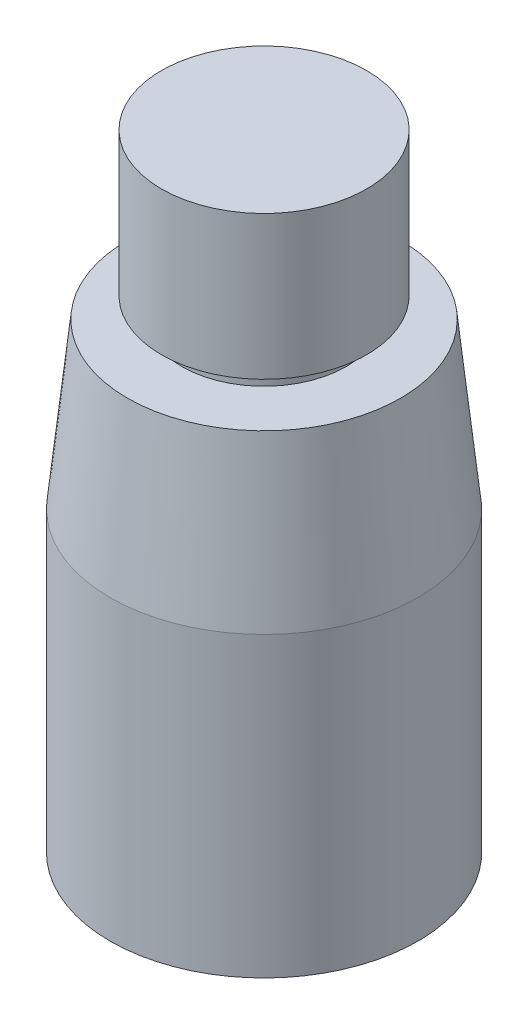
SolidWorks part; units mm, degrees
ref_plane "Front Plane" through (0, 0, 0) normal (0, 0, 1) x (1, 0, 0)
ref_plane "Top Plane" through (0, 0, 0) normal (0, 1, 0) x (1, 0, 0)
ref_plane "Right Plane" through (0, 0, 0) normal (1, 0, 0) x (0, 0, -1)
sketch "Sketch1" plane through (0, 0, 0) normal (0, 0, 1) x (1, 0, 0)
  line L0 (0, 85.1026) -> (0, 0) construction
  line L1 (0, 0) -> (-7.5, 0)
  line L2 (-7.5, 0) -> (-7.5, 14.5)
  line L3 (-7.5, 14.5) -> (-6.6592, 22.5)
  line L4 (-6.6592, 22.5) -> (-4, 22.5)
  line L5 (-4, 22.5) -> (-4, 23.5)
  line L6 (-4, 23.5) -> (-5, 23.5)
  line L7 (-5, 23.5) -> (-5, 30.5)
  line L8 (-5, 30.5) -> (0, 30.5)
  line L9 (0, 0) -> (0, 30.5)
  dimension "D1" = 30.5
  dimension "D2" = 1
  dimension "D3" = 8
  dimension "D4" = 6
  dimension "D5" = 7
  dimension "D6" = 7.5
  dimension "D7" = 5
  dimension "D8" = 1
revolve "Revolve1" add sketch "Sketch1" angle 360 about L0
